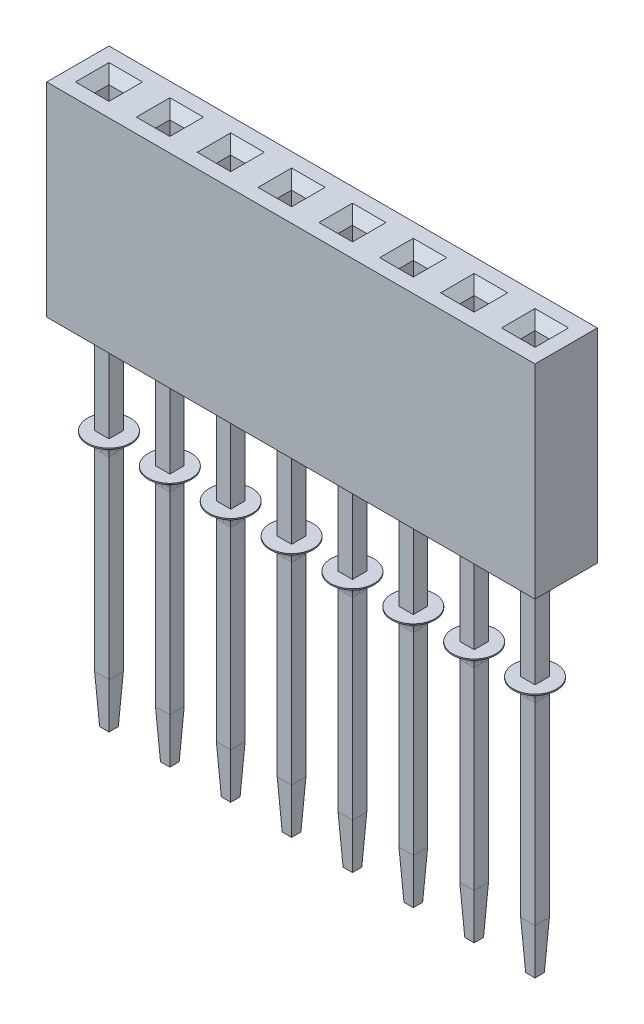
SolidWorks part; units mm, degrees
ref_plane "Plan de face" through (0, 0, 0) normal (0, 0, 1) x (1, 0, 0)
ref_plane "Plan de dessus" through (0, 0, 0) normal (0, 1, 0) x (1, 0, 0)
ref_plane "Plan de droite" through (0, 0, 0) normal (1, 0, 0) x (0, 0, -1)
sketch "Esquisse1" plane through (0, 0, 0) normal (0, 1, 0) x (1, 0, 0)
  line L1 (-1.3, -1.3) -> (1.3, -1.3)
  line L2 (-1.3, -1.3) -> (-1.3, 1.3)
  line L3 (-1.3, 1.3) -> (1.3, 1.3)
  line L4 (1.3, -1.3) -> (1.3, 1.3)
  line L5 (-1.3, -1.3) -> (1.3, 1.3) construction
  line L6 (-1.3, 1.3) -> (1.3, -1.3) construction
  line L7 (-0.3, -0.3) -> (0.3, -0.3)
  line L8 (-0.3, -0.3) -> (-0.3, 0.3)
  line L9 (-0.3, 0.3) -> (0.3, 0.3)
  line L10 (0.3, -0.3) -> (0.3, 0.3)
  line L11 (-0.3, -0.3) -> (0.3, 0.3) construction
  line L12 (-0.3, 0.3) -> (0.3, -0.3) construction
  point P0 (0, 0)
  point P5 (0, 0)
  dimension "D1" = 2.6
  dimension "D2" = 0.6
extrude "Boss.-Extru.1" add sketch "Esquisse1" along normal blind 8.5
chamfer "Chanfrein1" distance 0.4 angle 45 4 edges at (0.3, 8.5, 0) (0, 8.5, 0.3) (-0.3, 8.5, 0) (0, 8.5, -0.3)
sketch "Esquisse2" plane through (0, 0, 0) normal (0, -1, 0) x (1, 0, 0)
  line L1 (-0.3, -0.3) -> (0.3, -0.3)
  line L2 (-0.3, -0.3) -> (-0.3, 0.3)
  line L3 (-0.3, 0.3) -> (0.3, 0.3)
  line L4 (0.3, -0.3) -> (0.3, 0.3)
extrude "Boss.-Extru.2" add sketch "Esquisse2" along normal blind 14.8 separate body
chamfer "Chanfrein2" distance 2 angle 3 4 edges at (0, -14.8, 0.3) (0.3, -14.8, 0) (0, -14.8, -0.3) (-0.3, -14.8, 0)
ref_plane "Plan1" through (0, -4.1, 0) normal (0, -1, 0) x (-1, 0, 0)
sketch "Esquisse4" plane through (0, -4.1, 0) normal (0, -1, 0) x (-1, 0, 0)
  circle A0 centre (0, 0) radius 0.9
extrude "Boss.-Extru.3" add sketch "Esquisse4" along normal blind 0.05
fillet "Congé1" radius 0.6 4 edges at (0, -4.15, -0.3) (0.3, -4.15, 0) (0, -4.15, 0.3) (-0.3, -4.15, 0)
pattern_linear "Répétition linéaire4" count 8 spacing 2.54 along (1, 0, 0) of "Boss.-Extru.1", "Chanfrein1"
pattern_linear "Répétition linéaire6" count 8 spacing 2.54
